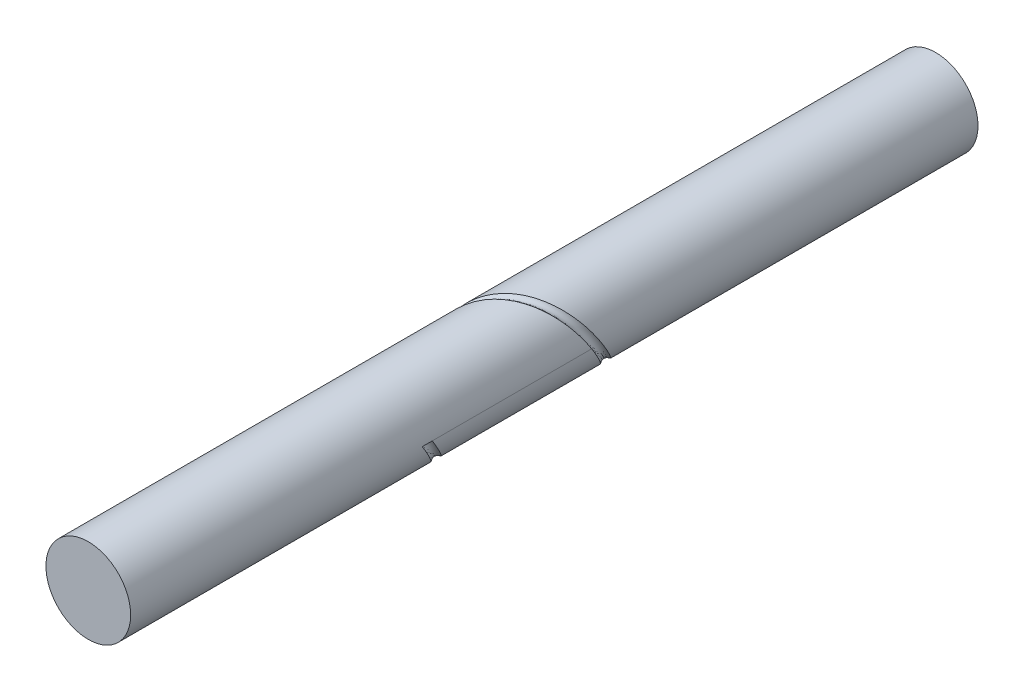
SolidWorks part; units mm, degrees
ref_plane "Front Plane" through (0, 0, 0) normal (0, 0, 1) x (1, 0, 0)
ref_plane "Top Plane" through (0, 0, 0) normal (0, 1, 0) x (1, 0, 0)
ref_plane "Right Plane" through (0, 0, 0) normal (1, 0, 0) x (0, 0, -1)
sketch "Sketch1" plane through (0, 0, 0) normal (0, 0, 1) x (1, 0, 0)
  circle A0 centre (0, 0) radius 25
  dimension "D1" = 50
extrude "Boss-Extrude1" add sketch "Sketch1" along normal blind 500
ref_plane "Plane1" through (0, 0, 175) normal (0, 0, 1) x (1, 0, 0)
sketch "Sketch2" plane through (0, 0, 175) normal (0, 0, 1) x (1, 0, 0)
  circle A0 centre (0, 0) radius 27.646
  dimension "D1" = 55.292
curve "Helix/Spiral1"
sketch "Sketch3" plane through (0, 0, 0) normal (0, 1, 0) x (1, 0, 0)
  circle A0 centre (-27.646, -175) radius 3.969
  spline S0 degree 3 poles (-27.646, -175) (-27.646, -176.3486) (-27.0448, -179.0553) (-24.3978, -183.1078) (-20.1762, -187.1623) (-14.6526, -191.2162) (-8.1834, -195.2703) (-1.1861, -199.3243) (5.8878, -203.3784) (12.5817, -207.4324) (18.4636, -211.4865) (23.154, -215.5405) (26.3502, -219.5946) (27.8459, -223.6486) (27.5446, -227.7027) (25.4657, -231.7568) (21.7434, -235.8108) (16.618, -239.8649) (10.4201, -243.9189) (3.5497, -247.973) (-3.5497, -252.027) (-10.4201, -256.0811) (-16.618, -260.1351) (-21.7434, -264.1892) (-25.4657, -268.2432) (-27.5446, -272.2973) (-27.8459, -276.3514) (-26.3502, -280.4054) (-23.154, -284.4595) (-18.4636, -288.5135) (-12.5817, -292.5676) (-5.8878, -296.6216) (1.1861, -300.6757) (8.1834, -304.7297) (14.6526, -308.7838) (20.1762, -312.8377) (24.3978, -316.8922) (27.0448, -320.9447) (27.646, -323.6514) (27.646, -325) knots 0 0 0 0 0.027027 0.054054 0.081081 0.108108 0.135135 0.162162 0.189189 0.216216 0.243243 0.27027 0.297297 0.324324 0.351351 0.378378 0.405405 0.432432 0.459459 0.486486 0.513514 0.540541 0.567568 0.594595 0.621622 0.648649 0.675676 0.702703 0.72973 0.756757 0.783784 0.810811 0.837838 0.864865 0.891892 0.918919 0.945946 0.972973 1 1 1 1 construction
  dimension "D1" = 7.938
sweep "Cut-Sweep1" cut profiles "Sketch3" path "Helix/Spiral1"
pattern_linear "LPattern1" [suppressed] count 2 spacing 500
